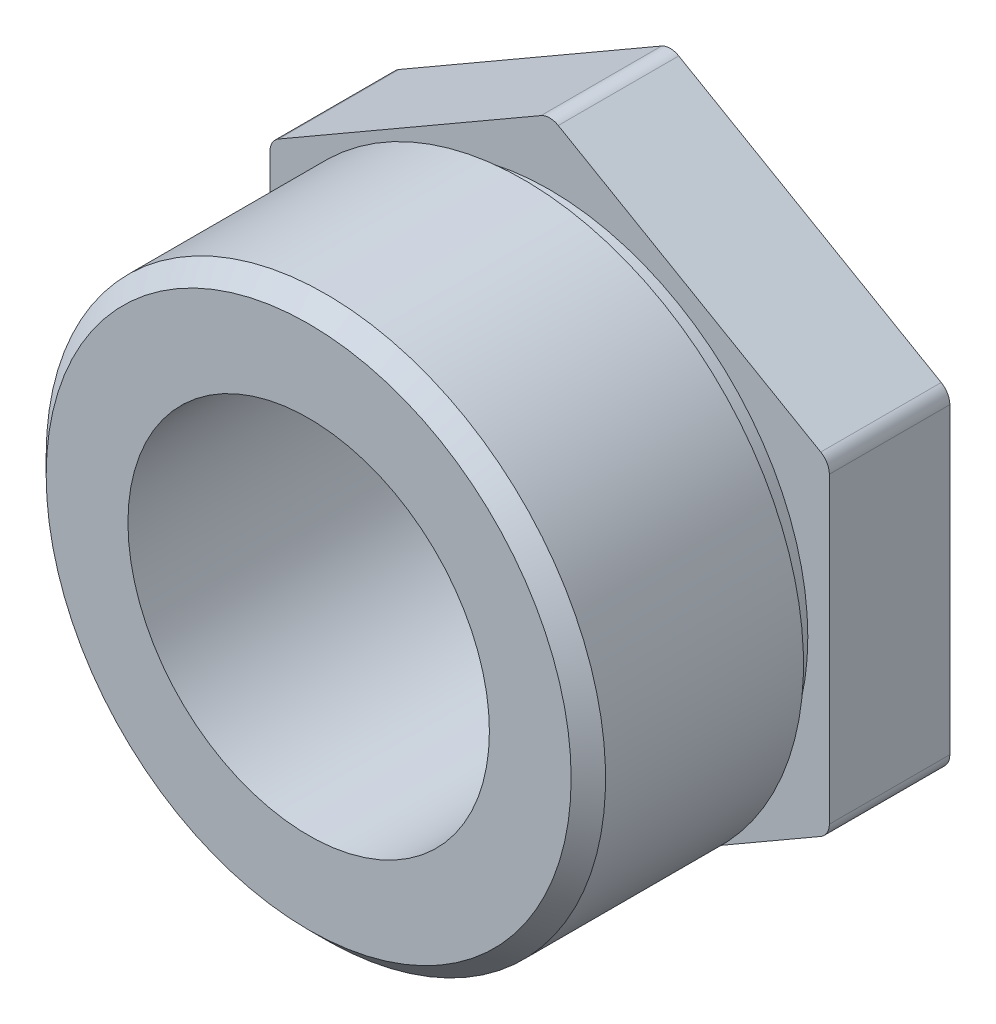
SolidWorks part; units mm, degrees
ref_plane "Front Plane" through (0, 0, 0) normal (0, 0, 1) x (1, 0, 0)
ref_plane "Top Plane" through (0, 0, 0) normal (0, 1, 0) x (1, 0, 0)
ref_plane "Right Plane" through (0, 0, 0) normal (1, 0, 0) x (0, 0, -1)
sketch "Sketch1" plane through (0, 0, 0) normal (0, 0, 1) x (1, 0, 0)
  circle A0 centre (0, 0) radius 32.5
  dimension "D1" = 65
extrude "Boss-Extrude1" add sketch "Sketch1" along normal blind 42
sketch "Sketch2" plane through (0, 0, 42) normal (0, 0, 1) x (1, 0, 0)
  circle A0 centre (0, 0) radius 30
  circle A1 centre (0, 0) radius 32.5
  circle A2 centre (0, 0) radius 32.5
  dimension "D2" = 60
  dimension "D1" = 0
extrude "Cut-Extrude1" cut sketch "Sketch2" along normal blind 3 from offset 28
sketch "Sketch3" plane through (0, 0, 0) normal (0, 0, -1) x (-1, 0, 0)
  line L1 (0, 37.5278) -> (-32.5, 18.7639)
  line L2 (-32.5, 18.7639) -> (-32.5, -18.7639)
  line L3 (-32.5, -18.7639) -> (0, -37.5278)
  line L4 (0, -37.5278) -> (32.5, -18.7639)
  line L5 (32.5, -18.7639) -> (32.5, 18.7639)
  line L6 (32.5, 18.7639) -> (0, 37.5278)
  circle A0 centre (0, 0) radius 32.5 construction
  circle A1 centre (0, 0) radius 32.5 construction
extrude "Boss-Extrude2" add sketch "Sketch3" against normal blind 14
fillet "Fillet1" radius 2 6 edges at (-32.5, 18.7639, 7) (-32.5, -18.7639, 7) (0, -37.5278, 7) (32.5, -18.7639, 7) (32.5, 18.7639, 7) (0, 37.5278, 7)
chamfer "Chamfer1" distance 2 angle 45 1 edges at (32.5, 0, 42)
sketch "Sketch4" plane through (0, 0, 42) normal (0, 0, 1) x (1, 0, 0)
  circle A0 centre (0, 0) radius 21
  dimension "D1" = 42
extrude "Cut-Extrude2" cut sketch "Sketch4" against normal through all
